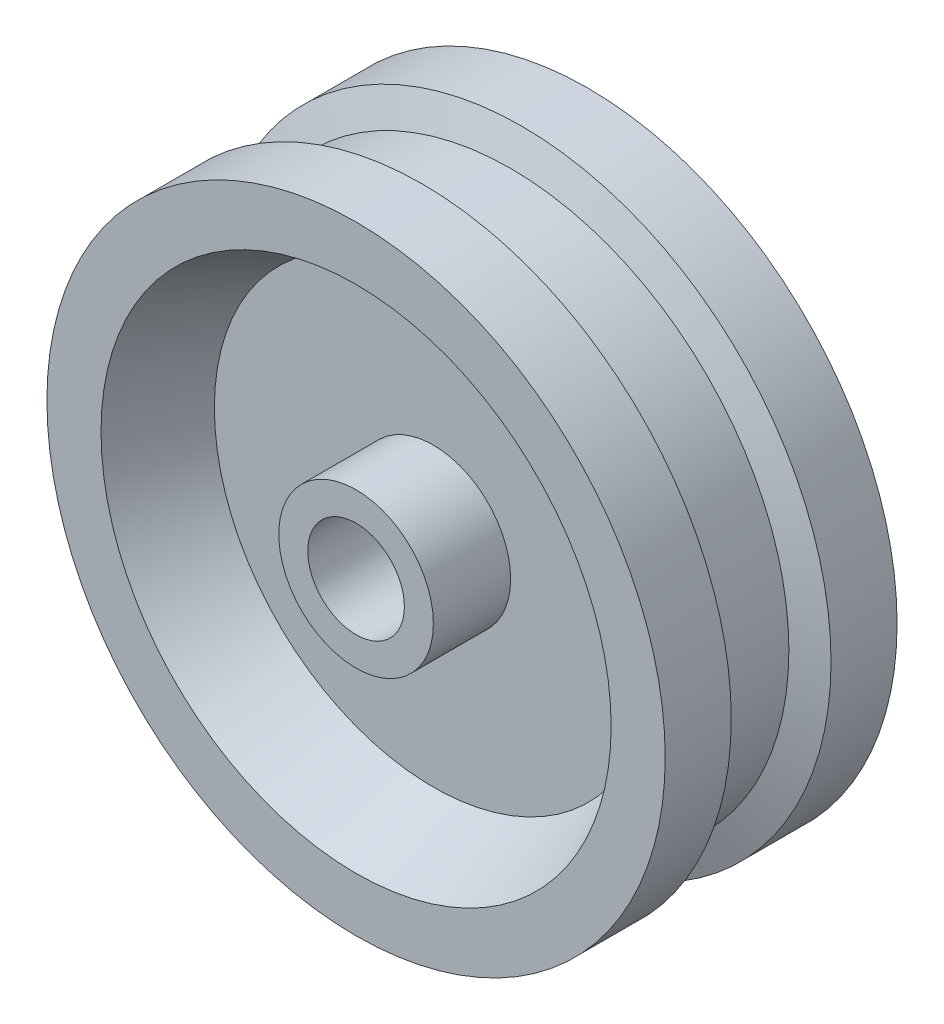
SolidWorks part; units mm, degrees
ref_plane "Front Plane" through (0, 0, 0) normal (0, 0, 1) x (1, 0, 0)
ref_plane "Top Plane" through (0, 0, 0) normal (0, 1, 0) x (1, 0, 0)
ref_plane "Right Plane" through (0, 0, 0) normal (1, 0, 0) x (0, 0, -1)
sketch "Sketch1" plane through (0, 0, 0) normal (1, 0, 0) x (0, 0, -1)
  line L0 (-2.5, 5) -> (-2.5, 14.1685)
  line L1 (-7.5, 5) -> (-2.5, 5)
  line L2 (-7.5, 5) -> (-7.5, 3.125)
  line L3 (-7.5, 3.125) -> (7.5, 3.125)
  line L4 (7.5, 5) -> (7.5, 3.125)
  line L6 (-7.5, 20) -> (-3.2279, 20)
  line L7 (-3.2279, 20) -> (-2.5, 18)
  line L8 (-2.5, 18) -> (2.5, 18)
  line L9 (-7.5, 20) -> (-7.5, 16.5)
  line L10 (0, 0) -> (0, 31.3255) construction
  line L11 (3.2279, 20) -> (2.5, 18)
  line L12 (7.5, 20) -> (3.2279, 20)
  line L13 (2.5, 5) -> (2.5, 14.1685)
  line L15 (7.5, 20) -> (7.5, 16.5)
  line L16 (2.5, 5) -> (7.5, 5)
  line L17 (-11.9698, 0) -> (10.9889, 0) construction
  line L18 (-7.5, 16.5) -> (-2.5, 14.1685)
  line L19 (7.5, 16.5) -> (2.5, 14.1685)
  dimension "D1" = 6.25
  dimension "D2" = 10
  dimension "D3" = 115
  dimension "D4" = 40
  dimension "D5" = 15
  dimension "D6" = 5
  dimension "D7" = 15
  dimension "D8" = 2
  dimension "D9" = 3.5
  dimension "D10" = 110
  dimension "D11" = 5
revolve "Revolve1" add sketch "Sketch1" angle 360 about L17
